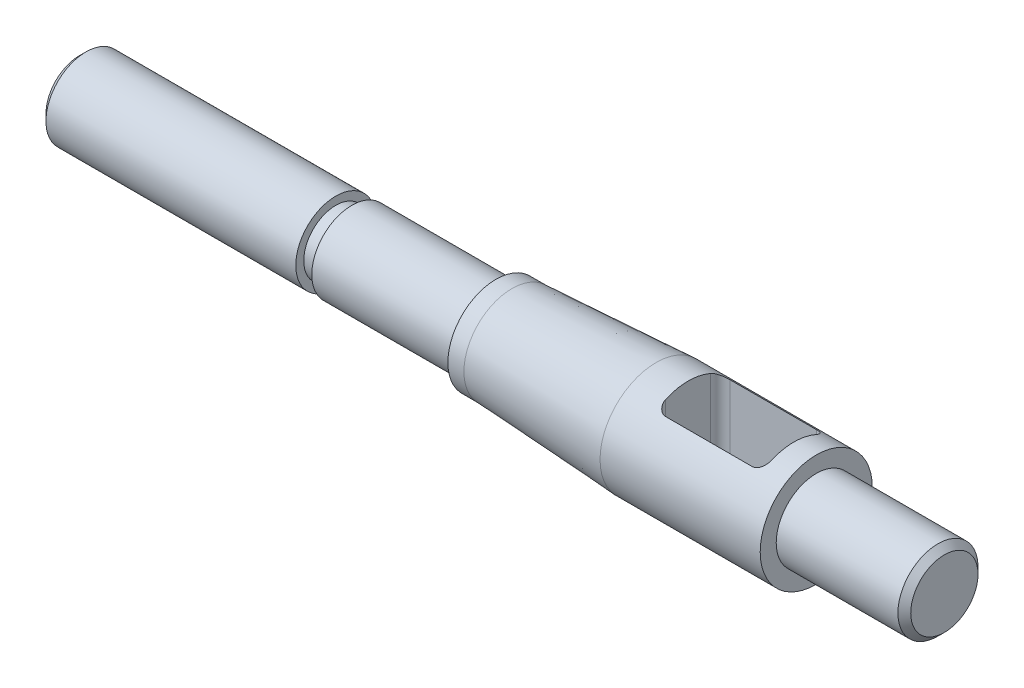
SolidWorks part; units mm, degrees
ref_plane "Face" through (0, 0, 0) normal (0, 0, 1) x (1, 0, 0)
ref_plane "Dessus" through (0, 0, 0) normal (0, 1, 0) x (1, 0, 0)
ref_plane "Droite" through (0, 0, 0) normal (1, 0, 0) x (0, 0, -1)
sketch "Esquisse1" plane through (0, 0, 0) normal (1, 0, 0) x (0, 0, -1)
  circle A0 centre (0, 0) radius 12.5
  dimension "D1" = 25
extrude "Extrusion1" add sketch "Esquisse1" along normal blind 130
sketch "Esquisse2" plane through (130, 0, 0) normal (1, 0, 0) x (0, 0, -1)
  circle A0 centre (0, 0) radius 17.5
  circle A1 centre (0, 0) radius 12.5 construction
  dimension "D1" = 35
extrude "Extrusion2" add sketch "Esquisse2" along normal blind 100
sketch "Esquisse3" plane through (230, 0, 0) normal (1, 0, 0) x (0, 0, -1)
  circle A0 centre (0, 0) radius 12.5
  circle A1 centre (0, 0) radius 17.5 construction
  circle A2 centre (0, 0) radius 12.5 construction
extrude "Extrusion3" add sketch "Esquisse3" along normal blind 40
sketch "Esquisse5" plane through (0, 0, 0) normal (0, 0, 1) x (1, 0, 0)
  line L0 (56.9444, 25.7803) -> (56.9444, 15)
  line L1 (56.9444, 15) -> (135, 15)
  line L2 (135, 15) -> (180, 17.5)
  line L3 (180, 17.5) -> (180, 30.5556)
  line L4 (180, 30.5556) -> (56.9444, 25.7803)
  line L5 (130, 17.5) -> (130, -17.5) construction
  line L6 (230, 17.5) -> (130, 17.5) construction
  line L7 (0, 0) -> (49.7222, 0) construction
  dimension "D1" = 5
  dimension "D2" = 50
  dimension "D3" = 15
revolve "Enlèvement de matière-Révolution1" cut sketch "Esquisse5" angle 360 about L7
sketch "Esquisse4" plane through (0, 0, 0) normal (0, 0, 1) x (1, 0, 0)
  line L0 (130, 17.5) -> (130, -17.5) construction
  line L1 (190, 23.0556) -> (223, 23.0556)
  line L2 (190, 23.0556) -> (190, -12)
  line L3 (190, -12) -> (223, -12)
  line L4 (223, 23.0556) -> (223, -12)
  dimension "D1" = 33
  dimension "D2" = 60
  dimension "D3" = 12
extrude "Enlèv. mat.-Extru.1" cut sketch "Esquisse4" against normal mid plane 20
chamfer "Chanfrein1" distance 2 angle 45 2 edges at (270, 0, -12.5) (0, 0, -12.5)
sketch "Esquisse6" plane through (0, 0, 0) normal (0, 0, 1) x (1, 0, 0)
  line L0 (130, 15) -> (130, -15) construction
  line L1 (80, 25.5556) -> (85, 25.5556)
  line L2 (80, 25.5556) -> (80, 10)
  line L3 (80, 10) -> (85, 10)
  line L4 (85, 25.5556) -> (85, 10)
  line L5 (0, 0) -> (20.5556, 0) construction
  dimension "D1" = 45
  dimension "D2" = 5
  dimension "D3" = 10
revolve "Enlèvement de matière-Révolution2" cut sketch "Esquisse6" angle 360 about L5
fillet "Congé1" radius 3 8 edges at (190, -12, 0) (206.5, -12, -10) (223, -12, 0) (206.5, -12, 10) (223, 1.1807, 10) (223, 1.1807, -10) (190, 1.1807, 10) (190, 1.1807, -10)
